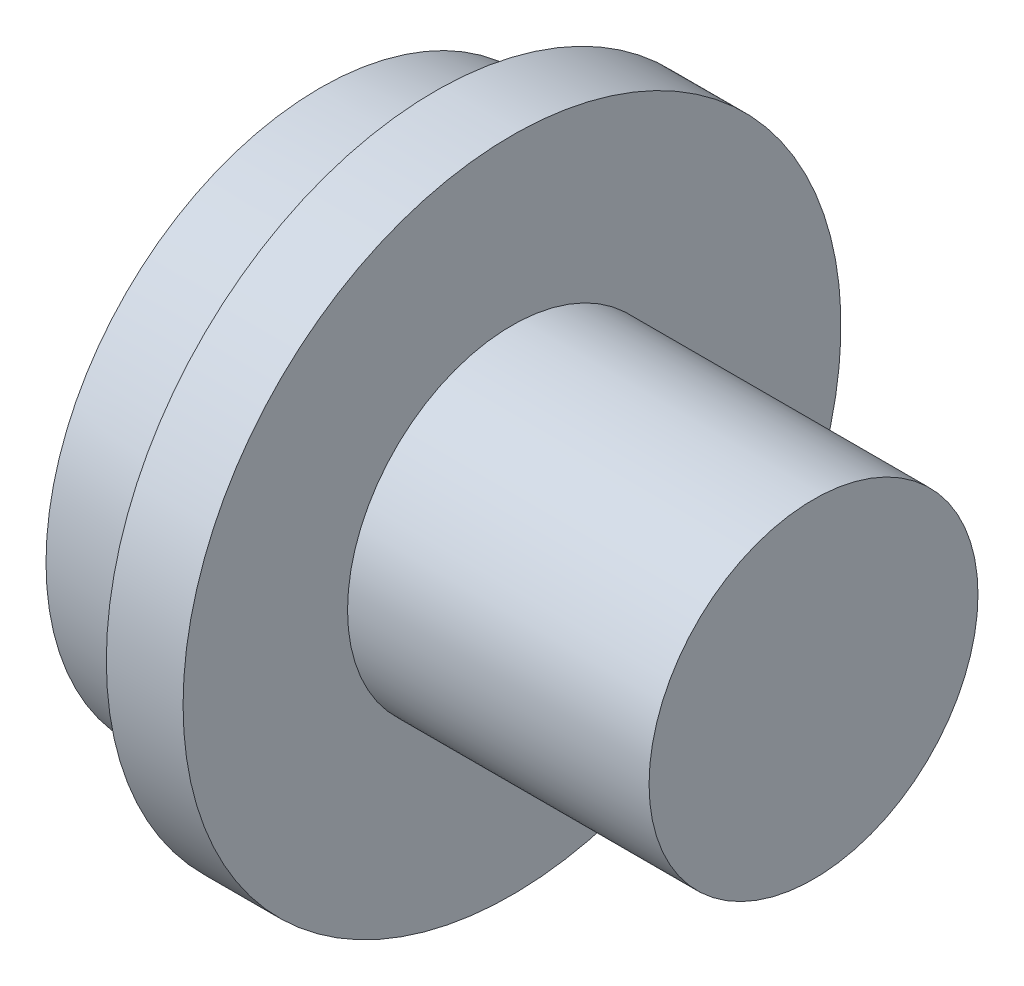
SolidWorks part; units mm, degrees
ref_plane "Plan de face" through (0, 0, 0) normal (0, 0, 1) x (1, 0, 0)
ref_plane "Plan de dessus" through (0, 0, 0) normal (0, 1, 0) x (1, 0, 0)
ref_plane "Plan de droite" through (0, 0, 0) normal (1, 0, 0) x (0, 0, -1)
sketch "Esquisse1" plane through (0, 0, 0) normal (0, 0, 1) x (1, 0, 0)
  line L0 (-55, 60) -> (-55, 30)
  line L1 (-55, 60) -> (-69, 60)
  line L2 (-69, 60) -> (-69, 51.579)
  line L3 (-69, 51.579) -> (-90, 50)
  line L4 (-90, 50) -> (-90, 35)
  line L5 (-90, 35) -> (-100, 35)
  line L6 (-100, 35) -> (-100, 0)
  line L7 (-100, 0) -> (0, 0)
  line L8 (-55, 30) -> (0, 30)
  line L9 (0, 30) -> (0, 0)
  dimension "D1" = 60
  dimension "D2" = 14
  dimension "D3" = 4.3
  dimension "D4" = 100
  dimension "D5" = 15
  dimension "D6" = 45
  dimension "D7" = 30
  dimension "D8" = 35
  dimension "D9" = 10
revolve "Révolution1" add sketch "Esquisse1" angle 360 about L7
